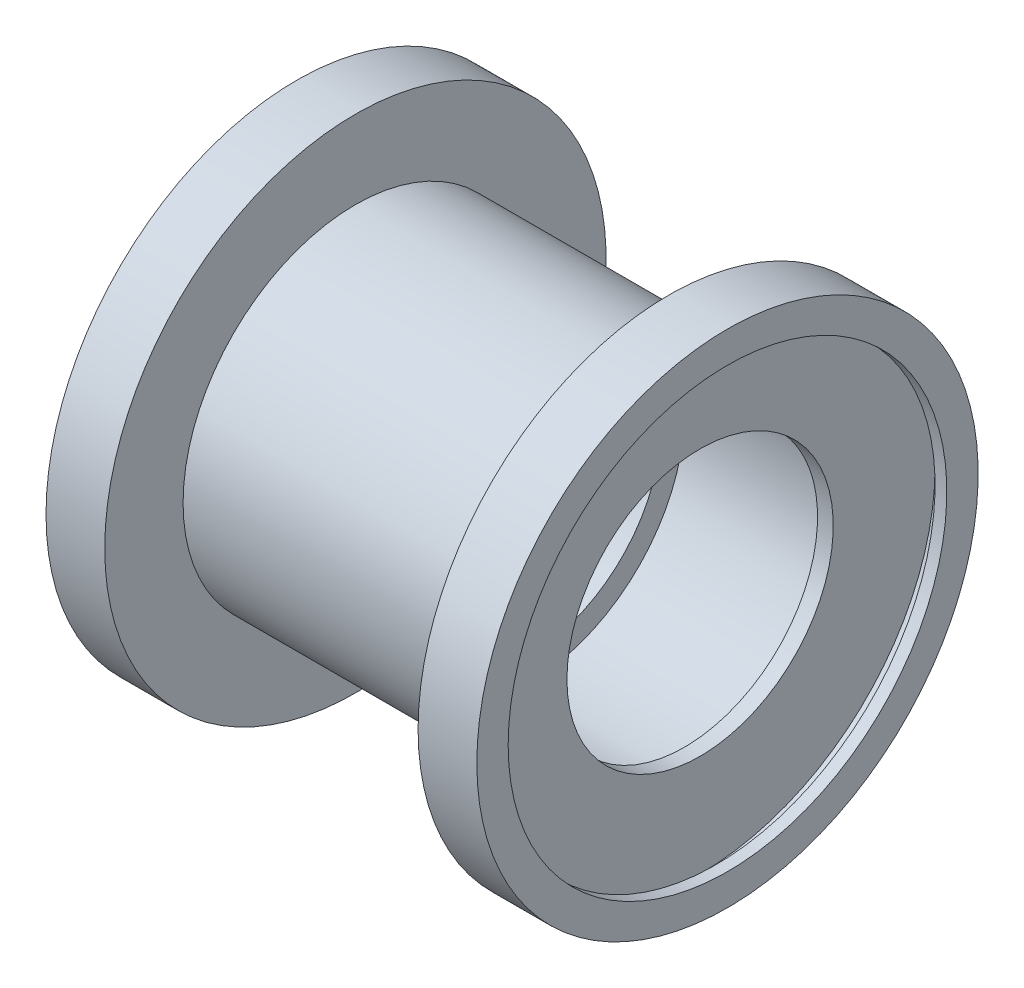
SolidWorks part; units mm, degrees
ref_plane "Plan1" through (0, 0, 0) normal (0, 0, 1) x (1, 0, 0)
ref_plane "Plan2" through (0, 0, 0) normal (0, 1, 0) x (1, 0, 0)
ref_plane "Plan3" through (0, 0, 0) normal (1, 0, 0) x (0, 0, -1)
sketch "Esquisse1" plane through (0, 0, 0) normal (0, 0, 1) x (1, 0, 0)
  line L0 (0, 8.5) -> (0, 11)
  line L1 (0, 11) -> (10, 11)
  line L2 (10, 11) -> (10, 16)
  line L3 (10, 16) -> (13.75, 16)
  line L4 (13.75, 16) -> (13.75, 14)
  line L5 (13.75, 14) -> (13, 14)
  line L6 (13, 14) -> (13, 15)
  line L7 (13, 15) -> (12, 15)
  line L8 (12, 15) -> (12, 8.5)
  line L9 (12, 8.5) -> (11, 8.5)
  line L10 (11, 8.5) -> (11, 10)
  line L11 (11, 10) -> (1, 10)
  line L12 (1, 10) -> (1, 8.5)
  line L13 (1, 8.5) -> (0, 8.5)
  line L14 (0, 0) -> (19, 0) construction
  dimension "D1" = 22
  dimension "D2" = 20
  dimension "D3" = 1
  dimension "D4" = 17
  dimension "D5" = 11
  dimension "D6" = 10
  dimension "D7" = 12
  dimension "D8" = 32
  dimension "D9" = 28
  dimension "D10" = 30
  dimension "D11" = 13.75
  dimension "D12" = 13
revolve "Base-Révolution" add sketch "Esquisse1" angle 360 about L14
mirror "Symétrie1" about plane through (0, 0, 0) normal (1, 0, 0)
